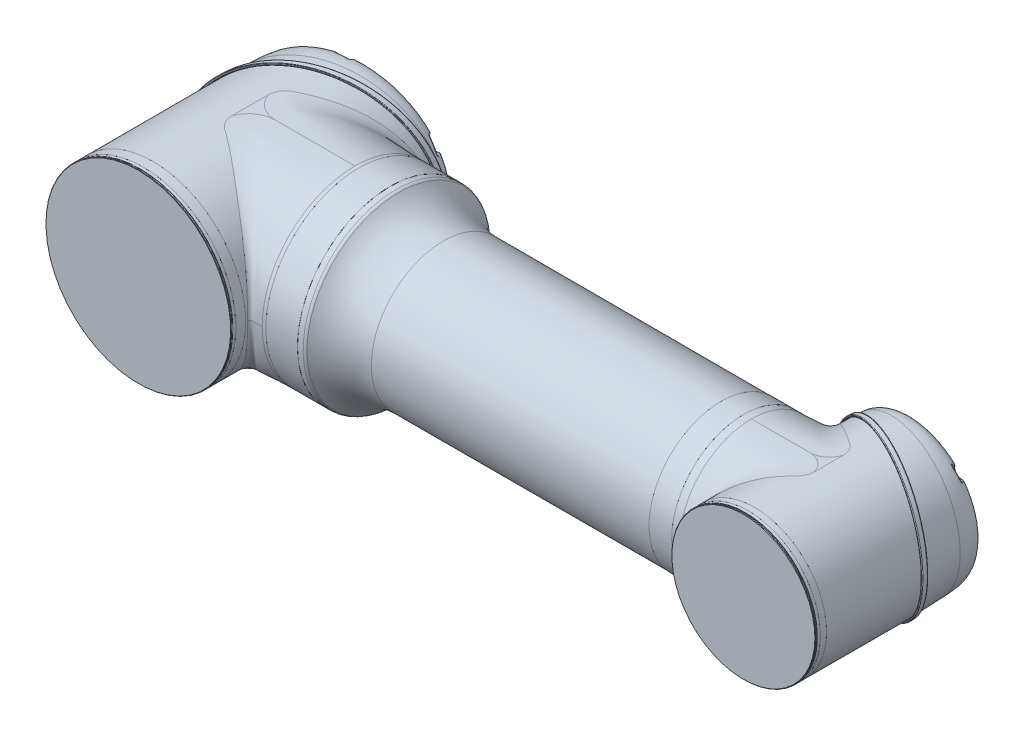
SolidWorks part; units mm, degrees
ref_plane "前视基准面" through (0, 0, 0) normal (0, 0, 1) x (1, 0, 0)
ref_plane "上视基准面" through (0, 0, 0) normal (0, 1, 0) x (1, 0, 0)
ref_plane "右视基准面" through (0, 0, 0) normal (1, 0, 0) x (0, 0, -1)
imported_body "CS612-Link1-1-solid1"
imported_body "CS612-Link1-1-solid2"
imported_body "CS612-Link1-1-solid3"
imported_body "CS612-J2-1-solid1"
imported_body "CS612-J2-1-solid2"
imported_body "CS612-J2-1-solid3"
imported_body "CS612-J2-1-solid4"
imported_body "CS612-J2-1-solid5"
imported_body "CS612-J2-1-solid6"
imported_body "CS612-J2-1-solid7"
imported_body "CS612-J2-1-solid8"
imported_body "CS612-J2-1-solid9"
imported_body "CS612-J2-1-solid10"
imported_body "CS612-J2-1-solid11"
imported_body "CS612-J2-1-solid12"
imported_body "CS612-J2-1-solid13"
imported_body "CS612-J2-1-solid14"
imported_body "CS612-J2-1-solid15"
imported_body "CS612-J2-1-solid16"
imported_body "CS612-J3-3-solid1"
imported_body "CS612-J3-3-solid2"
imported_body "CS612-J3-3-solid3"
imported_body "CS612-J3-3-solid4"
imported_body "CS612-J3-3-solid5"
imported_body "CS612-J3-3-solid6"
imported_body "CS612-J3-3-solid7"
imported_body "CS612-J3-3-solid8"
imported_body "CS612-J3-3-solid9"
imported_body "CS612-J3-3-solid10"
ref_plane "基准面1" through (300, 0, 0) normal (1, 0, 0) x (0, 0, -1)
split "分割1" trim tools "基准面1" bodies to split 108 resulting bodies 135 136
other "移动面1" parameters "D1"=140
move or copy body "实体-移动/复制1" bodies to move or copy 133 126 129 107 125 128 131 134 130 127 137 132 copy no translate (-140, 0, 0)
combine bodies "组合1" operation type add bodies to combine 136 148
